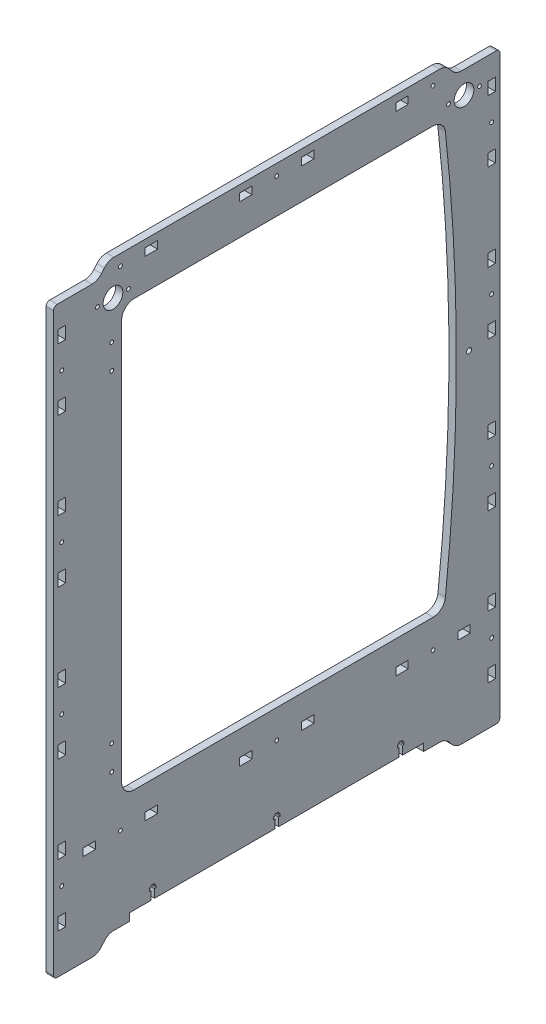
SolidWorks part; units mm, degrees
ref_plane "Спереди" through (0, 0, 0) normal (0, 0, 1) x (1, 0, 0)
ref_plane "Сверху" through (0, 0, 0) normal (0, 1, 0) x (1, 0, 0)
ref_plane "Справа" through (0, 0, 0) normal (1, 0, 0) x (0, 0, -1)
sketch "Эскиз1" plane through (0, 0, 0) normal (-1, 0, 0) x (0, -1, 0)
  line L0 (-471.1, 126) -> (-471.1, 0) construction
  line L3 (0, 0) -> (-558.4431, 0) construction
  line L4 (0, 0) -> (0, 200.825) construction
  line L5 (-77, 0) -> (-77, 159.0803) construction
  line L6 (-470, 173.25) -> (-422, 173.25) construction
  line L7 (-422, 173.25) -> (-422, 186.5928) construction
  line L8 (-452, 144.5) -> (-452, 119.5) construction
  line L9 (-392, 170.2) -> (-392, 176.3)
  line L10 (-402, 170.2) -> (-392, 170.2)
  line L11 (-402, 176.3) -> (-402, 170.2)
  line L12 (-392, 176.3) -> (-402, 176.3)
  line L13 (-332, 176.3) -> (-322, 176.3)
  line L14 (-332, 170.2) -> (-332, 176.3)
  line L15 (-322, 170.2) -> (-332, 170.2)
  line L16 (-322, 176.3) -> (-322, 170.2)
  line L17 (-282, 176.3) -> (-282, 170.2)
  line L18 (-272, 176.3) -> (-282, 176.3)
  line L19 (-282, 170.2) -> (-272, 170.2)
  line L20 (-272, 170.2) -> (-272, 176.3)
  line L21 (-212, 176.3) -> (-202, 176.3)
  line L22 (-212, 170.2) -> (-212, 176.3)
  line L23 (-202, 170.2) -> (-212, 170.2)
  line L24 (-202, 176.3) -> (-202, 170.2)
  line L25 (-162, 176.3) -> (-162, 170.2)
  line L26 (-152, 176.3) -> (-162, 176.3)
  line L27 (-162, 170.2) -> (-152, 170.2)
  line L28 (-152, 170.2) -> (-152, 176.3)
  line L29 (-452, -163.5) -> (-452, -138.5) construction
  line L30 (-473.5721, -141.3396) -> (-476.4279, -138.9433)
  line L31 (-470, -177) -> (-470, -149)
  line L32 (-3, -180) -> (-467, -180)
  line L33 (0, -149) -> (0, -177)
  line L34 (-6.4279, -138.9433) -> (-3.5721, -141.3396)
  line L35 (-474.15, -20) -> (-474.15, -30)
  line L36 (-468.05, -20) -> (-474.15, -20)
  line L37 (-468.05, -30) -> (-468.05, -20)
  line L38 (-474.15, -30) -> (-468.05, -30)
  line L39 (-452, 176.3) -> (-442, 176.3)
  line L40 (-442, 176.3) -> (-442, 170.2)
  line L41 (-442, 170.2) -> (-452, 170.2)
  line L42 (-452, 170.2) -> (-452, 176.3)
  line L43 (-468.05, -96) -> (-474.15, -96)
  line L44 (-468.05, -106) -> (-468.05, -96)
  line L45 (-474.15, -106) -> (-468.05, -106)
  line L46 (-474.15, -96) -> (-474.15, -106)
  line L47 (-80.05, -146) -> (-80.05, -156)
  line L48 (-73.95, -146) -> (-80.05, -146)
  line L49 (-73.95, -156) -> (-73.95, -146)
  line L50 (-80.05, -156) -> (-73.95, -156)
  line L51 (-73.95, -96) -> (-80.05, -96)
  line L52 (-73.95, -106) -> (-73.95, -96)
  line L53 (-80.05, -106) -> (-73.95, -106)
  line L54 (-80.05, -96) -> (-80.05, -106)
  line L55 (-80.05, -20) -> (-80.05, -30)
  line L56 (-73.95, -20) -> (-80.05, -20)
  line L57 (-73.95, -30) -> (-73.95, -20)
  line L58 (-80.05, -30) -> (-73.95, -30)
  line L59 (-452, -170.2) -> (-452, -176.3)
  line L60 (-442, -170.2) -> (-452, -170.2)
  line L61 (-442, -176.3) -> (-442, -170.2)
  line L62 (-452, -176.3) -> (-442, -176.3)
  line L63 (-152, -170.2) -> (-152, -176.3)
  line L64 (-162, -170.2) -> (-152, -170.2)
  line L65 (-152, -176.3) -> (-162, -176.3)
  line L66 (-162, -176.3) -> (-162, -170.2)
  line L67 (-202, -176.3) -> (-202, -170.2)
  line L68 (-202, -170.2) -> (-212, -170.2)
  line L69 (-212, -170.2) -> (-212, -176.3)
  line L70 (-212, -176.3) -> (-202, -176.3)
  line L71 (-272, -170.2) -> (-272, -176.3)
  line L72 (-282, -170.2) -> (-272, -170.2)
  line L73 (-272, -176.3) -> (-282, -176.3)
  line L74 (-282, -176.3) -> (-282, -170.2)
  line L75 (-80.05, 30) -> (-73.95, 30)
  line L76 (-73.95, 30) -> (-73.95, 20)
  line L77 (-73.95, 20) -> (-80.05, 20)
  line L78 (-80.05, 20) -> (-80.05, 30)
  line L79 (-80.05, 96) -> (-80.05, 106)
  line L80 (-80.05, 106) -> (-73.95, 106)
  line L81 (-73.95, 106) -> (-73.95, 96)
  line L82 (-73.95, 96) -> (-80.05, 96)
  line L83 (-80.05, 156) -> (-73.95, 156)
  line L84 (-73.95, 156) -> (-73.95, 146)
  line L85 (-73.95, 146) -> (-80.05, 146)
  line L86 (-80.05, 146) -> (-80.05, 156)
  line L87 (-474.15, 96) -> (-474.15, 106)
  line L88 (-474.15, 106) -> (-468.05, 106)
  line L89 (-468.05, 106) -> (-468.05, 96)
  line L90 (-468.05, 96) -> (-474.15, 96)
  line L91 (-322, -176.3) -> (-322, -170.2)
  line L92 (-322, -170.2) -> (-332, -170.2)
  line L93 (-332, -170.2) -> (-332, -176.3)
  line L94 (-332, -176.3) -> (-322, -176.3)
  line L95 (-474.15, 30) -> (-468.05, 30)
  line L96 (-468.05, 30) -> (-468.05, 20)
  line L97 (-468.05, 20) -> (-474.15, 20)
  line L98 (-474.15, 20) -> (-474.15, 30)
  line L99 (-392, -176.3) -> (-402, -176.3)
  line L100 (-402, -176.3) -> (-402, -170.2)
  line L101 (-402, -170.2) -> (-392, -170.2)
  line L102 (-392, -170.2) -> (-392, -176.3)
  line L103 (-92, 176.3) -> (-82, 176.3)
  line L104 (-92, 170.2) -> (-92, 176.3)
  line L105 (-82, 170.2) -> (-92, 170.2)
  line L106 (-82, 176.3) -> (-82, 170.2)
  line L107 (-10, -131.2829) -> (-10, 131.2829)
  line L108 (-6.4279, 138.9433) -> (-3.5721, 141.3396)
  line L109 (0, 149) -> (0, 177)
  line L110 (-3, 180) -> (-467, 180)
  line L111 (-470, 177) -> (-470, 149)
  line L112 (-473.5721, 141.3396) -> (-476.4279, 138.9433)
  line L113 (-480, 131.2829) -> (-480, -131.2829)
  line L114 (-42, 176.3) -> (-42, 170.2)
  line L115 (-32, 176.3) -> (-42, 176.3)
  line L116 (-42, 170.2) -> (-32, 170.2)
  line L117 (-32, 170.2) -> (-32, 176.3)
  line L118 (-32, -170.2) -> (-32, -176.3)
  line L119 (-42, -170.2) -> (-32, -170.2)
  line L120 (-32, -176.3) -> (-42, -176.3)
  line L121 (-42, -176.3) -> (-42, -170.2)
  line L122 (-82, -176.3) -> (-82, -170.2)
  line L123 (-82, -170.2) -> (-92, -170.2)
  line L124 (-92, -170.2) -> (-92, -176.3)
  line L125 (-92, -176.3) -> (-82, -176.3)
  circle A0 centre (-302, 173.25) radius 1.55
  circle A4 centre (-182, 173.25) radius 1.55
  circle A5 centre (-452, -163.5) radius 1.55
  circle A6 centre (-452, -138.5) radius 1.55
  circle A7 centre (-452, -151) radius 7.95
  circle A8 centre (-422, 173.25) radius 1.55
  arc A9 (-476.4279, -138.9433) -> (-480, -131.2829) centre (-470, -131.2829) cw
  arc A10 (-470, -149) -> (-473.5721, -141.3396) centre (-480, -149) ccw
  arc A11 (-467, -180) -> (-470, -177) centre (-467, -177) cw
  circle A12 centre (-77, 0) radius 1.55
  circle A13 centre (-77, 126) radius 1.55
  circle A14 centre (-471.1, 126) radius 1.55
  circle A15 centre (-471.1, 0) radius 1.55
  arc A16 (0, -177) -> (-3, -180) centre (-3, -177) cw
  arc A17 (-3.5721, -141.3396) -> (0, -149) centre (-10, -149) cw
  arc A18 (-10, -131.2829) -> (-6.4279, -138.9433) centre (0, -131.2829) ccw
  circle A19 centre (-471.1, -126) radius 1.55
  circle A20 centre (-77, -126) radius 1.55
  arc A21 (-10, 131.2829) -> (-6.4279, 138.9433) centre (0, 131.2829) cw
  arc A22 (-3.5721, 141.3396) -> (0, 149) centre (-10, 149) ccw
  arc A23 (0, 177) -> (-3, 180) centre (-3, 177) ccw
  arc A24 (-467, 180) -> (-470, 177) centre (-467, 177) ccw
  arc A25 (-470, 149) -> (-473.5721, 141.3396) centre (-480, 149) cw
  arc A26 (-476.4279, 138.9433) -> (-480, 131.2829) centre (-470, 131.2829) ccw
  circle A27 centre (-422, -173.25) radius 1.55
  circle A28 centre (-182, -173.25) radius 1.55
  circle A29 centre (-452, 132) radius 7.95
  circle A30 centre (-452, 119.5) radius 1.55
  circle A31 centre (-452, 144.5) radius 1.55
  circle A35 centre (-302, -173.25) radius 1.55
  circle A36 centre (-62, 173.25) radius 1.55
  circle A37 centre (-62, -173.25) radius 1.55
  point P0 (-471.1, 20)
  point P2 (-77, 20)
  point P11 (-442, 173.25)
  point P15 (-10, 0)
  point P17 (-452, -151)
  point P20 (-77, 146)
  point P92 (-480, 0)
  dimension "D2" = 10
  dimension "D5" = 3
  dimension "D10" = 3.1
  dimension "D15" = 252
  dimension "D20" = 15.9
  dimension "D21" = 283
  dimension "D25" = 4
  dimension "D26" = 120
  dimension "D22" = 18
  dimension "D1" = 360
  dimension "D3" = 50
  dimension "D4" = 31
  dimension "D6" = 10
  dimension "D7" = 480
  dimension "D8" = 10
  dimension "D9" = 8.9
  dimension "D11" = 40
  dimension "D12" = 10
  dimension "D13" = 6.1
  dimension "D14" = 76
  dimension "D16" = 77
  dimension "D17" = 6.75
  dimension "D18" = 58
  dimension "D19" = 40
  dimension "D23" = 40
  dimension "D24" = 25
  dimension "D27" = 151
extrude "Бобышка-Вытянуть1" add sketch "Эскиз1" against normal blind 6
sketch "Эскиз2" plane through (0, 0, 0) normal (-1, 0, 0) x (0, 0, 1)
  line L0 (-126.058, 443) -> (115, 443)
  line L1 (125, 433) -> (125, 110)
  line L2 (115, 100) -> (-126.058, 100)
  line L3 (125, 271.5) -> (1355.1637, 271.5) construction
  line L4 (180, 3) -> (180, 467) construction
  line L5 (131.2829, 480) -> (-131.2829, 480) construction
  line L6 (-177, 0) -> (-149, 0) construction
  arc A0 (-135.9991, 434.0839) -> (-135.9991, 108.9161) centre (1355.1637, 271.5) ccw
  arc A1 (-126.058, 100) -> (-135.9991, 108.9161) centre (-126.058, 110) cw
  arc A2 (125, 110) -> (115, 100) centre (115, 110) cw
  arc A3 (-126.058, 443) -> (-135.9991, 434.0839) centre (-126.058, 433) ccw
  arc A4 (115, 443) -> (125, 433) centre (115, 433) cw
  point P14 (125, 100)
  point P17 (-135, 443)
  point P20 (125, 443)
  dimension "D4" = 1500
  dimension "D6" = 10
  dimension "D1" = 55
  dimension "D2" = 37
  dimension "D3" = 100
  dimension "D5" = 260
extrude "Вырез-Вытянуть1" cut sketch "Эскиз2" against normal through all
sketch "Эскиз3" plane through (0, 0, 0) normal (-1, 0, 0) x (0, 0, 1)
  line L0 (0, 0) -> (0, 165.1485) construction
  line L1 (-131.2829, 10) -> (131.2829, 10) construction
  line L2 (-118.5, 10) -> (118.5, 10)
  line L3 (-118.5, 10) -> (-118.5, 16)
  line L4 (-118.5, 16) -> (118.5, 16)
  line L5 (118.5, 10) -> (118.5, 16)
  point P9 (0, 16)
  dimension "D1" = 237
  dimension "D2" = 6
extrude "Вырез-Вытянуть2" cut sketch "Эскиз3" against normal through all
sketch "Эскиз4" plane through (0, 0, 0) normal (-1, 0, 0) x (0, 0, 1)
  line L0 (0, 0) -> (0, 139.4946) construction
  line L1 (-1.55, 16) -> (1.55, 16)
  line L2 (118.5, 16) -> (-118.5, 16) construction
  line L3 (1.55, 16) -> (1.55, 22.8)
  line L4 (1.55, 22.8) -> (2.75, 22.8)
  line L5 (2.75, 22.8) -> (2.75, 25)
  line L6 (2.75, 25) -> (1.55, 25)
  line L7 (1.55, 25) -> (1.55, 26.5)
  line L8 (1.55, 26.5) -> (-1.55, 26.5)
  line L9 (-1.55, 25) -> (-1.55, 26.5)
  line L10 (-2.75, 25) -> (-1.55, 25)
  line L11 (-2.75, 22.8) -> (-2.75, 25)
  line L12 (-1.55, 22.8) -> (-2.75, 22.8)
  line L13 (-1.55, 16) -> (-1.55, 22.8)
  line L14 (101.55, 26.5) -> (98.45, 26.5)
  line L15 (98.45, 25) -> (98.45, 26.5)
  line L16 (97.25, 25) -> (98.45, 25)
  line L17 (97.25, 22.8) -> (97.25, 25)
  line L18 (98.45, 22.8) -> (97.25, 22.8)
  line L19 (98.45, 16) -> (98.45, 22.8)
  line L20 (98.45, 16) -> (101.55, 16)
  line L21 (101.55, 16) -> (101.55, 22.8)
  line L22 (102.75, 22.8) -> (102.75, 25)
  line L23 (102.75, 25) -> (101.55, 25)
  line L24 (101.55, 25) -> (101.55, 26.5)
  line L25 (101.55, 22.8) -> (102.75, 22.8)
  line L26 (-101.55, 22.8) -> (-102.75, 22.8)
  line L27 (-101.55, 25) -> (-101.55, 26.5)
  line L28 (-102.75, 25) -> (-101.55, 25)
  line L29 (-102.75, 22.8) -> (-102.75, 25)
  line L30 (-101.55, 16) -> (-101.55, 22.8)
  line L31 (-98.45, 16) -> (-101.55, 16)
  line L32 (-98.45, 16) -> (-98.45, 22.8)
  line L33 (-98.45, 22.8) -> (-97.25, 22.8)
  line L34 (-97.25, 22.8) -> (-97.25, 25)
  line L35 (-97.25, 25) -> (-98.45, 25)
  line L36 (-98.45, 25) -> (-98.45, 26.5)
  line L37 (-101.55, 26.5) -> (-98.45, 26.5)
  point P14 (0, 26.5)
  point P19 (0, 16)
  dimension "D1" = 10.5
  dimension "D2" = 1.5
  dimension "D3" = 2.2
  dimension "D4" = 3.1
  dimension "D5" = 5.5
  dimension "D7" = 100
  dimension "D6" = 2
extrude "Вырез-Вытянуть3" cut sketch "Эскиз4" against normal through all
sketch "Эскиз5" plane through (0, 0, 0) normal (-1, 0, 0) x (0, 0, 1)
  line L0 (125, 271.5) -> (-269.8629, 271.5) construction
  line L1 (125, 110) -> (125, 433) construction
  line L2 (133, 421.5) -> (133, 401.5) construction
  line L3 (133, 121.5) -> (133, 141.5) construction
  circle A0 centre (133, 421.5) radius 1.55
  circle A1 centre (133, 401.5) radius 1.55
  circle A2 centre (133, 141.5) radius 1.55
  circle A3 centre (133, 121.5) radius 1.55
  point P8 (133, 411.5)
  dimension "D2" = 3.1
  dimension "D1" = 140
  dimension "D3" = 8
  dimension "D4" = 20
extrude "Вырез-Вытянуть4" cut sketch "Эскиз5" against normal through all
sketch "Эскиз6" plane through (0, 0, 0) normal (-1, 0, 0) x (0, 0, 1)
  line L0 (125, 271.5) -> (-228.8627, 271.5) construction
  line L1 (125, 110) -> (125, 433) construction
  circle A0 centre (-155, 271.5) radius 2.05
  dimension "D1" = 4.1
  dimension "D2" = 280
extrude "Вырез-Вытянуть5" cut sketch "Эскиз6" against normal through all
